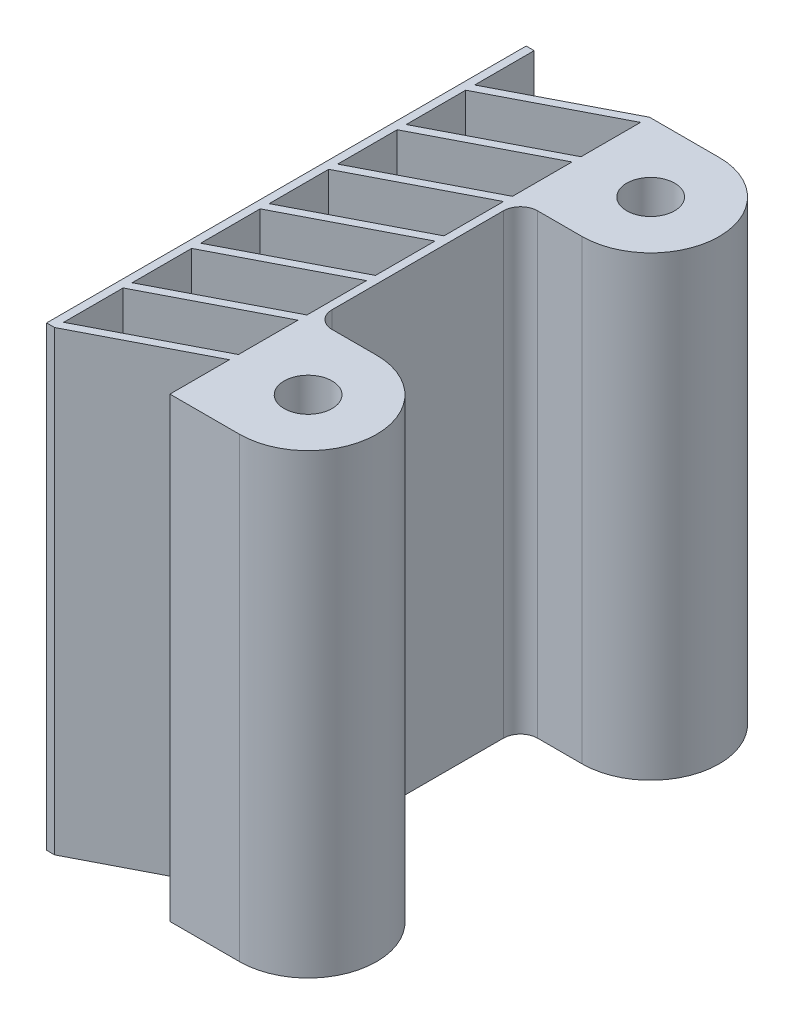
SolidWorks part; units mm, degrees
ref_plane "前视基准面" through (0, 0, 0) normal (0, 0, 1) x (1, 0, 0)
ref_plane "上视基准面" through (0, 0, 0) normal (0, 1, 0) x (1, 0, 0)
ref_plane "右视基准面" through (0, 0, 0) normal (1, 0, 0) x (0, 0, -1)
other "Configuration Table"
sketch "草图1" plane through (0, 0, 0) normal (0, 1, 0) x (1, 0, 0)
  line L0 (215.6676, 208.5965) -> (-208.5965, -215.6676) construction
  line L1 (0, 0) -> (-250, 0) construction
  line L2 (0, 0) -> (0, -250) construction
  line L3 (0, -250) -> (-250, -250) construction
  line L4 (-250, 0) -> (-250, -250) construction
  line L5 (215.6676, 208.5965) -> (208.5965, 215.6676) construction
  line L6 (-208.5965, -215.6676) -> (-215.6676, -208.5965) construction
  line L7 (208.5965, 215.6676) -> (-215.6676, -208.5965) construction
  line L8 (215.6676, 208.5965) -> (-215.6676, -208.5965) construction
  line L9 (-208.5965, -215.6676) -> (208.5965, 215.6676) construction
  line L10 (-208.5965, -208.5965) -> (-194.4544, -194.4544) construction
  line L11 (-173.2412, -180.3122) -> (-180.3122, -173.2412) construction
  line L12 (-180.3122, -173.2412) -> (-239.1009, -200.4628) construction
  line L13 (-242, -205) -> (-242, -235) construction
  line L14 (-237, -240) -> (-232.9289, -240) construction
  line L15 (-232.9289, -240) -> (-173.2412, -180.3122) construction
  line L16 (-200.8183, -188.0904) -> (-212.132, -199.4041) construction
  line L17 (-223.4457, -210.7178) -> (-216.3747, -217.7889) construction
  line L18 (-237, -199) -> (-253.9, -199)
  line L19 (-253.9, -199) -> (-253.9, -241)
  line L20 (-253.9, -241) -> (-237, -241)
  line L21 (-237, -229) -> (-242.4, -229)
  line L22 (-242.4, -229) -> (-242.4, -211)
  line L23 (-242.4, -211) -> (-237, -211)
  circle A0 centre (-208.5965, -208.5965) radius 2.1 construction
  circle A1 centre (-194.4544, -194.4544) radius 2.1 construction
  circle A2 centre (-180.3122, -180.3122) radius 2.1 construction
  circle A3 centre (-237, -235) radius 2.1
  circle A4 centre (-237, -220) radius 1.6 construction
  circle A5 centre (-237, -205) radius 2.1
  arc A6 (-242, -235) -> (-237, -240) centre (-237, -235) ccw construction
  arc A7 (-239.1009, -200.4628) -> (-242, -205) centre (-237, -205) ccw construction
  circle A8 centre (-200.8183, -188.0904) radius 1.6 construction
  circle A9 centre (-212.132, -199.4041) radius 1.6 construction
  circle A10 centre (-223.4457, -210.7178) radius 1.6 construction
  circle A11 centre (-216.3747, -217.7889) radius 1.6 construction
  arc A12 (-237, -241) -> (-237, -229) centre (-237, -235) ccw
  arc A13 (-237, -211) -> (-237, -199) centre (-237, -205) ccw
  dimension "D8" = 4.2
  dimension "D13" = 4.2
  dimension "D16" = 5
  dimension "D17" = 3.2
  dimension "D23" = 3.2
  dimension "D25" = 6
  dimension "D1" = 250
  dimension "D2" = 250
  dimension "D3" = 45
  dimension "D4" = 600
  dimension "D5" = 10
  dimension "D7" = 20
  dimension "D9" = 5
  dimension "D10" = 5
  dimension "D11" = 10
  dimension "D12" = 8
  dimension "D14" = 30
  dimension "D15" = 15
  dimension "D18" = 5
  dimension "D20" = 16
  dimension "D21" = 4
  dimension "D22" = 25
  dimension "D24" = 10
  dimension "D26" = 3.9
  dimension "D27" = 0.4
  dimension "D6" = 3
  dimension "D19" = 3
extrude "凸台-拉伸1" add sketch "草图1" along normal blind 40
sketch "草图2" plane through (0, 40, 0) normal (0, 1, 0) x (1, 0, 0)
  line L3 (-253.2, -199) -> (-243.1, -193.7877)
  line L27 (-237, -199) -> (-253.9, -199) construction
  line L92 (-243.1, -193.7877) -> (-243.1, -199)
  line L99 (-243.1, -199) -> (-253.2, -204.2123)
  line L110 (-253.2, -204.2123) -> (-253.2, -199)
  line L207 (-253.2, -205) -> (-243.1, -199.7877)
  line L218 (-243.1, -199.7877) -> (-243.1, -205)
  line L267 (-243.1, -205) -> (-253.2, -210.2123)
  line L272 (-253.2, -210.2123) -> (-253.2, -205)
  line L303 (-253.2, -211) -> (-243.1, -205.7877)
  line L308 (-243.1, -205.7877) -> (-243.1, -211)
  line L370 (-243.1, -211) -> (-253.2, -216.2123)
  line L378 (-253.2, -216.2123) -> (-253.2, -211)
  line L379 (-253.2, -217) -> (-243.1, -211.7877)
  line L380 (-243.1, -211.7877) -> (-243.1, -217)
  line L381 (-243.1, -217) -> (-253.2, -222.2123)
  line L382 (-253.2, -222.2123) -> (-253.2, -217)
  line L383 (-253.2, -223) -> (-243.1, -217.7877)
  line L385 (-243.1, -217.7877) -> (-243.1, -223)
  line L387 (-243.1, -223) -> (-253.2, -228.2123)
  line L388 (-253.2, -228.2123) -> (-253.2, -223)
  line L389 (-253.2, -229) -> (-243.1, -223.7877)
  line L390 (-243.1, -223.7877) -> (-243.1, -229)
  line L391 (-243.1, -229) -> (-253.2, -234.2123)
  line L393 (-253.2, -234.2123) -> (-253.2, -229)
  line L395 (-253.2, -235) -> (-243.1, -229.7877)
  line L397 (-243.1, -229.7877) -> (-243.1, -235)
  line L399 (-243.1, -235) -> (-253.2, -240.2123)
  line L401 (-253.2, -240.2123) -> (-253.2, -235)
  line L403 (-253.2, -241) -> (-243.1, -235.7877)
  line L405 (-243.1, -235.7877) -> (-243.1, -241)
  line L407 (-243.1, -241) -> (-253.2, -246.2123)
  line L409 (-253.2, -246.2123) -> (-253.2, -241)
  line L411 (-253.2, -247) -> (-243.1, -241.7877)
  line L412 (-243.1, -241.7877) -> (-243.1, -247)
  line L413 (-243.1, -247) -> (-253.2, -252.2123)
  line L414 (-253.2, -252.2123) -> (-253.2, -247)
  line L415 (-253.2, -253) -> (-243.1, -247.7877)
  line L417 (-243.1, -247.7877) -> (-243.1, -253)
  line L420 (-243.1, -253) -> (-253.2, -258.2123)
  line L422 (-253.2, -258.2123) -> (-253.2, -253)
  line L424 (-253.2, -259) -> (-243.1, -253.7877)
  line L426 (-243.1, -253.7877) -> (-243.1, -259)
  line L428 (-243.1, -259) -> (-253.2, -264.2123)
  line L430 (-253.2, -264.2123) -> (-253.2, -259)
  line L432 (-253.2, -265) -> (-243.1, -259.7877)
  line L434 (-243.1, -259.7877) -> (-243.1, -265)
  line L435 (-243.1, -265) -> (-253.2, -270.2123)
  line L436 (-253.2, -270.2123) -> (-253.2, -265)
  line L437 (-253.2, -271) -> (-243.1, -265.7877)
  line L438 (-243.1, -265.7877) -> (-243.1, -271)
  line L439 (-243.1, -271) -> (-253.2, -276.2123)
  line L440 (-253.2, -276.2123) -> (-253.2, -271)
  line L441 (-242.4, -229) -> (-242.4, -211) construction
  line L442 (-253.9, -199) -> (-253.9, -241) construction
  line L447 (-253.9, -241) -> (-237, -241) construction
  point P5 (-250.7, -262)
  point P9 (-250.7, -255)
  point P10 (-250.7, -248)
  point P11 (-250.7, -241)
  point P15 (-250.7, -234)
  point P17 (-250.7, -227)
  point P18 (-250.7, -220)
  point P19 (-250.7, -213)
  point P20 (-250.7, -206)
  point P21 (-250.7, -199)
  point P22 (-247.2, -174.5)
  point P23 (-250.7, -192)
  point P24 (-250.7, -185)
  point P25 (-250.7, -178)
  point P26 (-247.2, -265.5)
  point P27 (-247.2, -258.5)
  point P28 (-247.2, -251.5)
  point P29 (-247.2, -244.5)
  point P30 (-247.2, -237.5)
  point P31 (-247.2, -230.5)
  point P32 (-247.2, -181.5)
  point P33 (-247.2, -223.5)
  point P34 (-247.2, -216.5)
  point P35 (-247.2, -209.5)
  point P36 (-247.2, -202.5)
  point P37 (-247.2, -195.5)
  point P38 (-247.2, -188.5)
  point P85 (-253.3, -238.6006)
  point P86 (-253.3, -255.8547)
  point P87 (0, 0)
  point P88 (0, 0)
  point P89 (-253.3, -246.6646)
  point P90 (-253.3, -241)
  point P91 (0, 0)
  point P92 (-253.3, -240.6299)
  point P93 (0, 0)
  point P94 (0, 0)
  point P95 (0, 0)
  point P96 (0, 0)
  point P97 (0, 0)
  point P98 (0, 0)
  point P100 (0, 0)
  dimension "D3" = 0.7
  dimension "D4" = 0.7
  dimension "D2" = 0.7
  dimension "D1" = 13
fillet "圆角1" radius 1.5 2 edges at (-242.4, 20, 211) (-242.4, 20, 229)
extrude "切除-拉伸1" cut sketch "草图2" against normal through all
